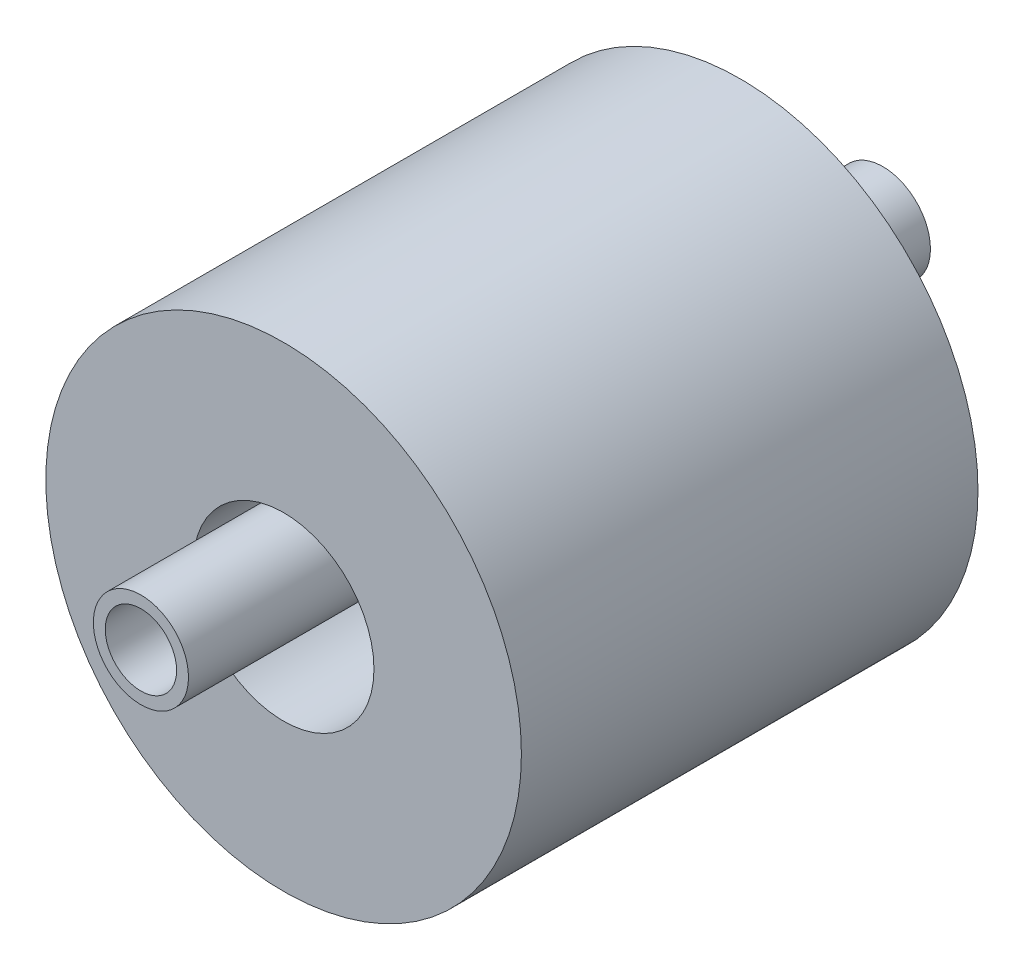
SolidWorks part; units mm, degrees
ref_plane "Plan de face" through (0, 0, 0) normal (0, 0, 1) x (1, 0, 0)
ref_plane "Plan de dessus" through (0, 0, 0) normal (0, 1, 0) x (1, 0, 0)
ref_plane "Plan de droite" through (0, 0, 0) normal (1, 0, 0) x (0, 0, -1)
sketch "Esquisse1" plane through (0, 0, 0) normal (0, 0, 1) x (1, 0, 0)
  circle A0 centre (0, 0) radius 50
  circle A1 centre (0, 0) radius 19
  dimension "D1" = 100
  dimension "D2" = 38
extrude "Boss.-Extru.1" add sketch "Esquisse1" along normal blind 96
sketch "Esquisse2" plane through (0, 0, 96) normal (0, 0, 1) x (1, 0, 0)
  circle A0 centre (0, 9) radius 10
  circle A1 centre (0, 9) radius 7.5
  circle A2 centre (0, 0) radius 19 construction
  point P3 (0, 0)
  point P4 (0, -7.3472)
  point P7 (0, 9)
  dimension "D1" = 20
  dimension "D2" = 15
extrude "Boss.-Extru.2" add sketch "Esquisse2" against normal blind 126 and the other way blind 30 separate body
